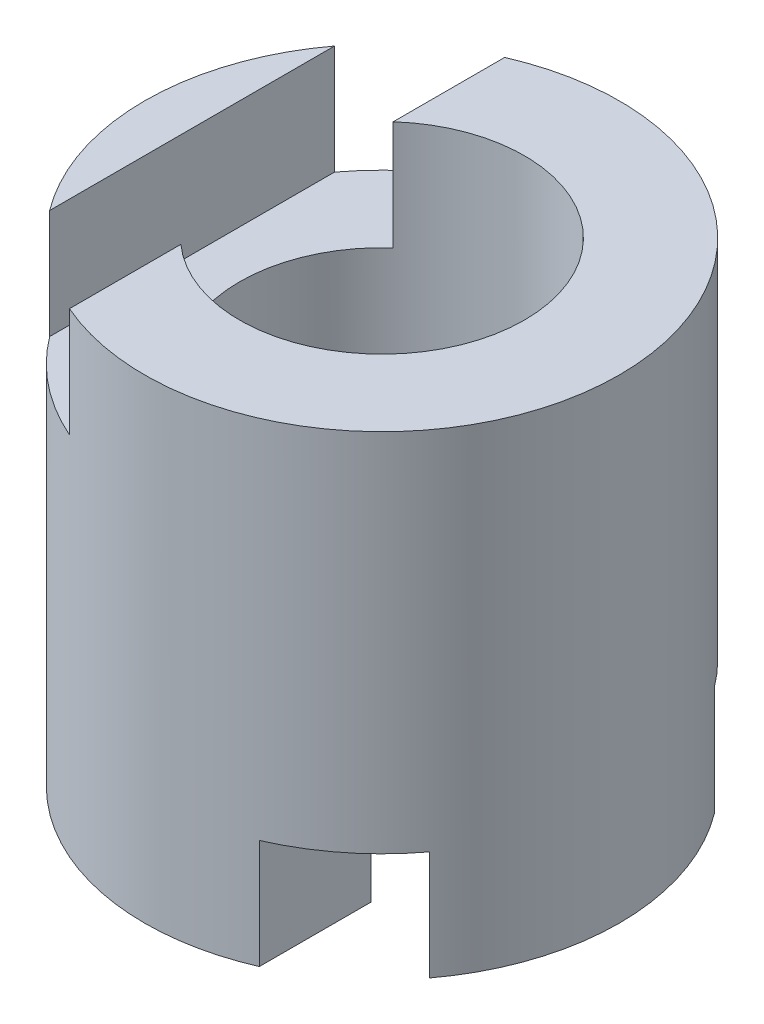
SolidWorks part; units mm, degrees
ref_plane "前视基准面" through (0, 0, 0) normal (0, 0, 1) x (1, 0, 0)
ref_plane "上视基准面" through (0, 0, 0) normal (0, 1, 0) x (1, 0, 0)
ref_plane "右视基准面" through (0, 0, 0) normal (1, 0, 0) x (0, 0, -1)
other "Configuration Table"
sketch "草图1" plane through (0, 0, 0) normal (0, 1, 0) x (1, 0, 0)
  circle A0 centre (0, 0) radius 30
  circle A1 centre (0, 0) radius 50
extrude "凸台-拉伸1" add sketch "草图1" against normal blind 100
sketch "草图2" plane through (0, 0, 0) normal (0, 0, 1) x (1, 0, 0)
  line L1 (50, 0) -> (-50, 0) construction
  line L2 (-40, 0) -> (-40, -23)
  line L3 (-40, -23) -> (-20, -23)
  line L4 (-20, -23) -> (-20, 0)
  line L5 (-20, 0) -> (-40, 0)
  line L8 (-50, -100) -> (50, -100) construction
  line L9 (40, -100) -> (40, -77)
  line L10 (40, -77) -> (20, -77)
  line L11 (20, -77) -> (20, -100)
  line L12 (20, -100) -> (40, -100)
extrude "切除-拉伸1" cut sketch "草图2" against normal through all and the other way through all
